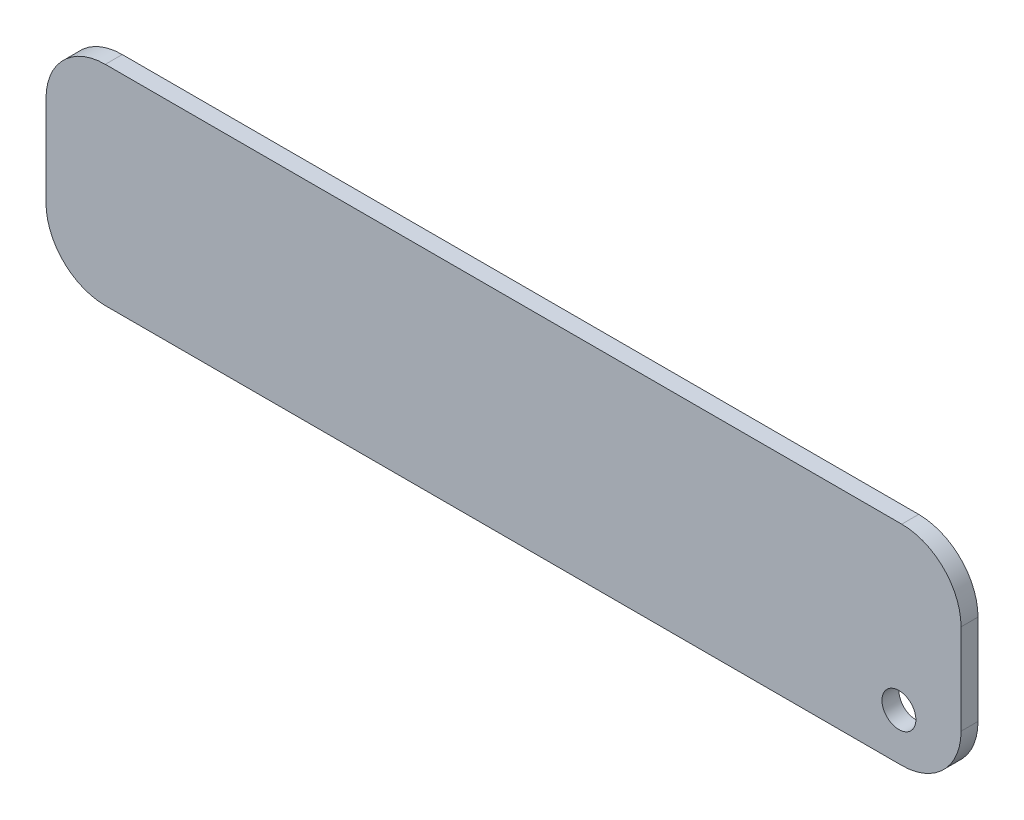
SolidWorks part; units mm, degrees
ref_plane "Спереди" through (0, 0, 0) normal (0, 0, 1) x (1, 0, 0)
ref_plane "Сверху" through (0, 0, 0) normal (0, 1, 0) x (1, 0, 0)
ref_plane "Справа" through (0, 0, 0) normal (1, 0, 0) x (0, 0, -1)
sketch "Эскиз1" plane through (0, 0, 0) normal (0, 0, 1) x (1, 0, 0)
  line L1 (-70.5, 18.5) -> (70.5, 18.5)
  line L2 (-81, 8) -> (-81, -8)
  line L3 (-70.5, -18.5) -> (70.5, -18.5)
  line L4 (81, 8) -> (81, -8)
  line L5 (-81, 18.5) -> (81, -18.5) construction
  line L6 (-81, -18.5) -> (81, 18.5) construction
  arc A2 (70.5, -18.5) -> (81, -8) centre (70.5, -8) ccw
  arc A3 (81, 8) -> (70.5, 18.5) centre (70.5, 8) ccw
  arc A4 (-81, -8) -> (-70.5, -18.5) centre (-70.5, -8) ccw
  arc A5 (-70.5, 18.5) -> (-81, 8) centre (-70.5, 8) ccw
  point P0 (0, 0)
  dimension "D3" = 10.5
  dimension "D1" = 162
  dimension "D2" = 37
extrude "Бобышка-Вытянуть1" add sketch "Эскиз1" along normal blind 3
sketch "Эскиз2" plane through (0, 0, 3) normal (0, 0, 1) x (1, 0, 0)
  line L0 (70, 18.5) -> (70, -18.5) construction
  line L1 (70.5, 18.5) -> (-70.5, 18.5) construction
  line L2 (-70.5, -18.5) -> (70.5, -18.5) construction
  line L3 (81, -10.25) -> (-81, -10.25) construction
  line L4 (81, -8) -> (81, 8) construction
  line L5 (-81, 8) -> (-81, -8) construction
  line L6 (-81, 8) -> (-81, -18.5) construction
  line L7 (-81, -18.5) -> (0, -18.5) construction
  circle A0 centre (70, -10.25) radius 3
  dimension "D1" = 6
  dimension "D2" = 11
  dimension "D3" = 8.25
extrude "Вырез-Вытянуть1" cut sketch "Эскиз2" against normal through all
